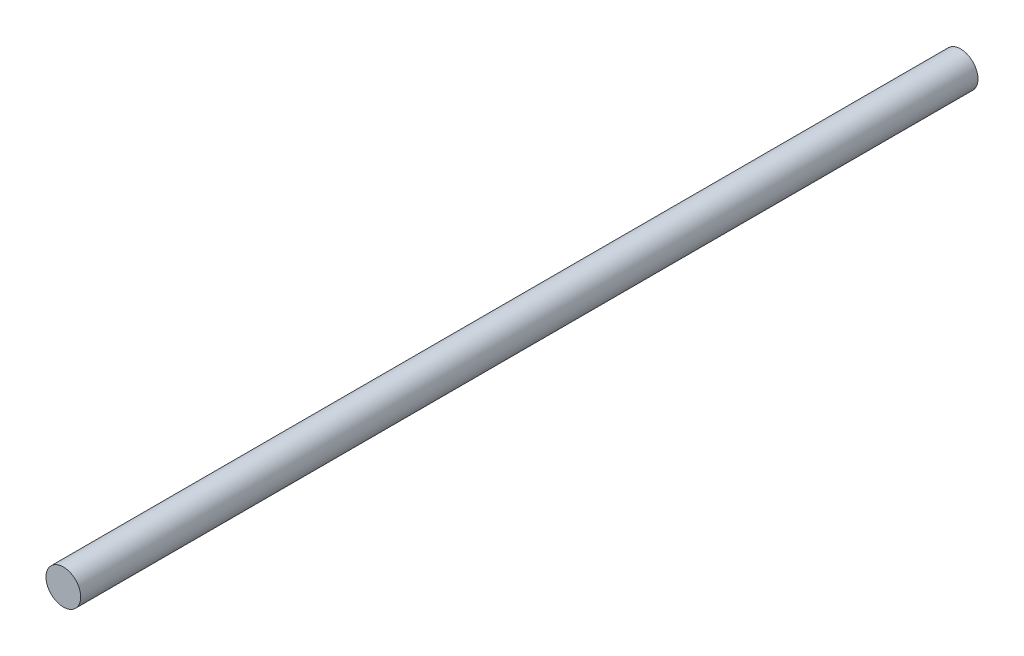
SolidWorks part; units mm, degrees
ref_plane "Front Plane" through (0, 0, 0) normal (0, 0, 1) x (1, 0, 0)
ref_plane "Top Plane" through (0, 0, 0) normal (0, 1, 0) x (1, 0, 0)
ref_plane "Right Plane" through (0, 0, 0) normal (1, 0, 0) x (0, 0, -1)
sketch "Sketch1" plane through (0, 0, 0) normal (0, 0, 1) x (1, 0, 0)
  circle A0 centre (0, 0) radius 30
  dimension "D1" = 60
extrude "Boss-Extrude1" add sketch "Sketch1" against normal blind 1550
